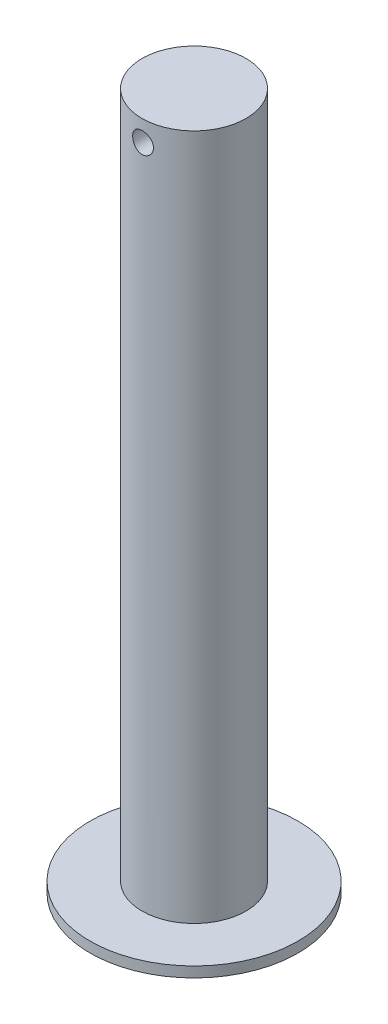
SolidWorks part; units mm, degrees
other "DetailItem2"
ref_plane "Front Plane" through (0, 0, 0) normal (0, 0, 1) x (1, 0, 0)
ref_plane "Top Plane" through (0, 0, 0) normal (0, 1, 0) x (1, 0, 0)
ref_plane "Right Plane" through (0, 0, 0) normal (1, 0, 0) x (0, 0, -1)
sketch "Sketch1" plane through (0, 0, 0) normal (0, 1, 0) x (1, 0, 0)
  circle A0 centre (0, 0) radius 12.7
  dimension "D1" = 25.4
extrude "Extrude1" add sketch "Sketch1" along normal blind 167.64
sketch "Sketch3" plane through (0, 0, 0) normal (0, 0, 1) x (1, 0, 0)
  circle A0 centre (0, 162.56) radius 2.54
  dimension "D1" = 5.08
  dimension "D2" = 162.56
extrude "Cut-Extrude1" cut sketch "Sketch3" against normal through all and the other way through all
sketch "Sketch4" plane through (0, 0, 0) normal (0, -1, 0) x (1, 0, 0)
  circle A0 centre (0, 0) radius 10.3187
  circle A1 centre (0, 0) radius 25.4
  dimension "D1" = 20.6375
  dimension "D2" = 50.8
extrude "Extrude2" add sketch "Sketch4" along normal blind 2.54 separate body
other "Fillet Bead2" parameters "D10"=6.35, "D11"=1.27, "D12"=0, "D13"=3.175, "D14"=0
